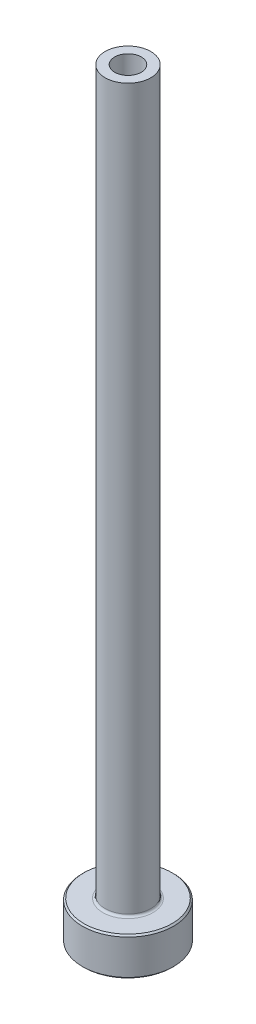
SolidWorks part; units mm, degrees
ref_plane "Front Plane" through (0, 0, 0) normal (0, 0, 1) x (1, 0, 0)
ref_plane "Top Plane" through (0, 0, 0) normal (0, 1, 0) x (1, 0, 0)
ref_plane "Right Plane" through (0, 0, 0) normal (1, 0, 0) x (0, 0, -1)
sketch "Sketch1" plane through (0, 0, 0) normal (0, 0, 1) x (1, 0, 0)
  line L0 (-1.75, 100) -> (-3, 100)
  line L1 (-3, 100) -> (-3, 5)
  line L2 (-3, 5) -> (-6, 5)
  line L3 (-6, 5) -> (-6, 0)
  line L4 (5.5, 0) -> (-5.5, 0) construction
  line L5 (-6, 0) -> (-2, 0)
  line L6 (-1.75, 55) -> (-1.75, 100)
  line L7 (0, 92.1877) -> (0, -15.5353) construction
  line L8 (0, -5.5) -> (0, 5.5) construction
  line L9 (-1.75, 55) -> (-2, 43)
  line L10 (-2, 43) -> (-2, 0)
  dimension "D1" = 0.25
  dimension "ID" = 3.5
  dimension "OD" = 6
  dimension "L" = 100
  dimension "H" = 12
  dimension "T" = 5
  dimension "N" = 45
  dimension "D2" = 12
revolve "Revolve1" add sketch "Sketch1" angle 360 about L7
fillet "Fillet1" radius 0.3 1 edges at (0, 5, 3)
chamfer "Chamfer1" distance 0.2 angle 45 2 edges at (0, 5, 6) (0, 0, 6)
chamfer "Chamfer3" distance 0.5 angle 45 1 edges at (0, 0, 2)
